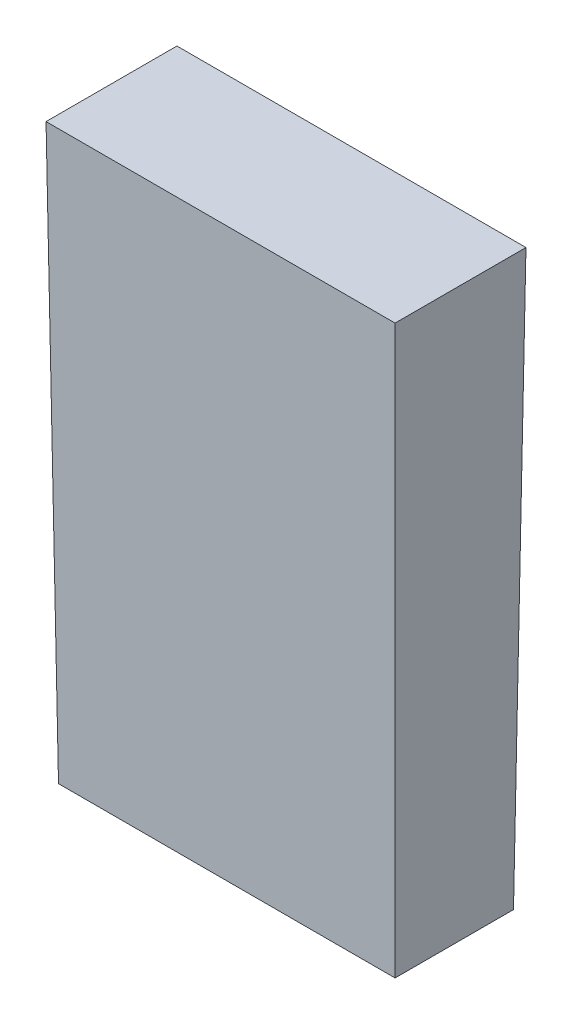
SolidWorks part; units mm, degrees
ref_plane "Front Plane" through (0, 0, 0) normal (0, 0, 1) x (1, 0, 0)
ref_plane "Top Plane" through (0, 0, 0) normal (0, 1, 0) x (1, 0, 0)
ref_plane "Right Plane" through (0, 0, 0) normal (1, 0, 0) x (0, 0, -1)
sketch "Sketch1" plane through (0, 0, 0) normal (0, 0, 1) x (1, 0, 0)
  line L0 (0, 0) -> (0, 73.025) construction
  line L1 (0, 0) -> (42.8625, 0)
  line L2 (0, 0) -> (-0.7937, 73.025)
  line L3 (-0.7937, 73.025) -> (43.6562, 73.025)
  line L4 (42.8625, 0) -> (43.6562, 73.025)
  line L5 (42.8625, 0) -> (42.8625, 73.025) construction
  line L6 (0, 73.025) -> (-0.7937, 73.025) construction
  line L7 (42.8625, 73.025) -> (43.6562, 73.025) construction
  dimension "D1" = 73.025
  dimension "D2" = 42.8625
  dimension "D3" = 44.45
extrude "Boss-Extrude1" add sketch "Sketch1" along normal blind 16.6687
sketch "Sketch2" plane through (0, -0.2329, 0) normal (1, 0, 0) x (0, 0, -1)
  line L0 (-0.7937, 0.2329) -> (-15.875, 0.2329)
  line L1 (-16.6687, 0.2329) -> (0, 0.2329) construction
  line L2 (-15.875, 0.2329) -> (-16.6687, 73.2579)
  line L3 (-16.6687, 73.2579) -> (0, 73.2579)
  line L4 (0, 73.2579) -> (-0.7937, 0.2329)
  line L5 (-15.875, 0.2329) -> (-16.6687, 0.2329)
  line L6 (-16.6687, 0.2329) -> (-16.6687, 73.2579)
  line L7 (0, 73.2579) -> (0, 0.2329)
  line L8 (0, 0.2329) -> (-0.7937, 0.2329)
  point P5 (-8.3344, 0.2329)
  point P6 (-8.3344, 0.2329)
  dimension "D1" = 15.0812
extrude "Cut-Extrude1" cut sketch "Sketch2" against normal through all both and the other way through all
